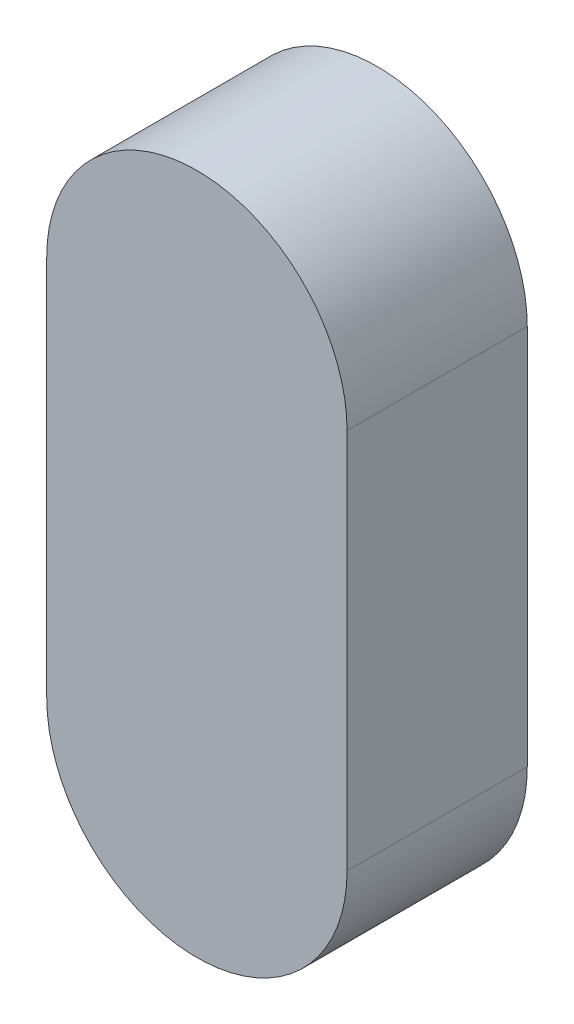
SolidWorks part; units mm, degrees
ref_plane "Front Plane" through (0, 0, 0) normal (0, 0, 1) x (1, 0, 0)
ref_plane "Top Plane" through (0, 0, 0) normal (0, 1, 0) x (1, 0, 0)
ref_plane "Right Plane" through (0, 0, 0) normal (1, 0, 0) x (0, 0, -1)
sketch "Sketch1" plane through (0, 0, 0) normal (0, 0, 1) x (1, 0, 0)
  line L0 (0, 0) -> (0, 25.4) construction
  line L1 (-10, 0) -> (-10, 25.4)
  line L2 (10, 0) -> (10, 25.4)
  arc A0 (-10, 0) -> (10, 0) centre (0, 0) ccw
  arc A1 (10, 25.4) -> (-10, 25.4) centre (0, 25.4) ccw
  point P3 (0, 12.7)
  dimension "D1" = 25.4
  dimension "D2" = 20
extrude "Boss-Extrude1" add sketch "Sketch1" along normal blind 12
